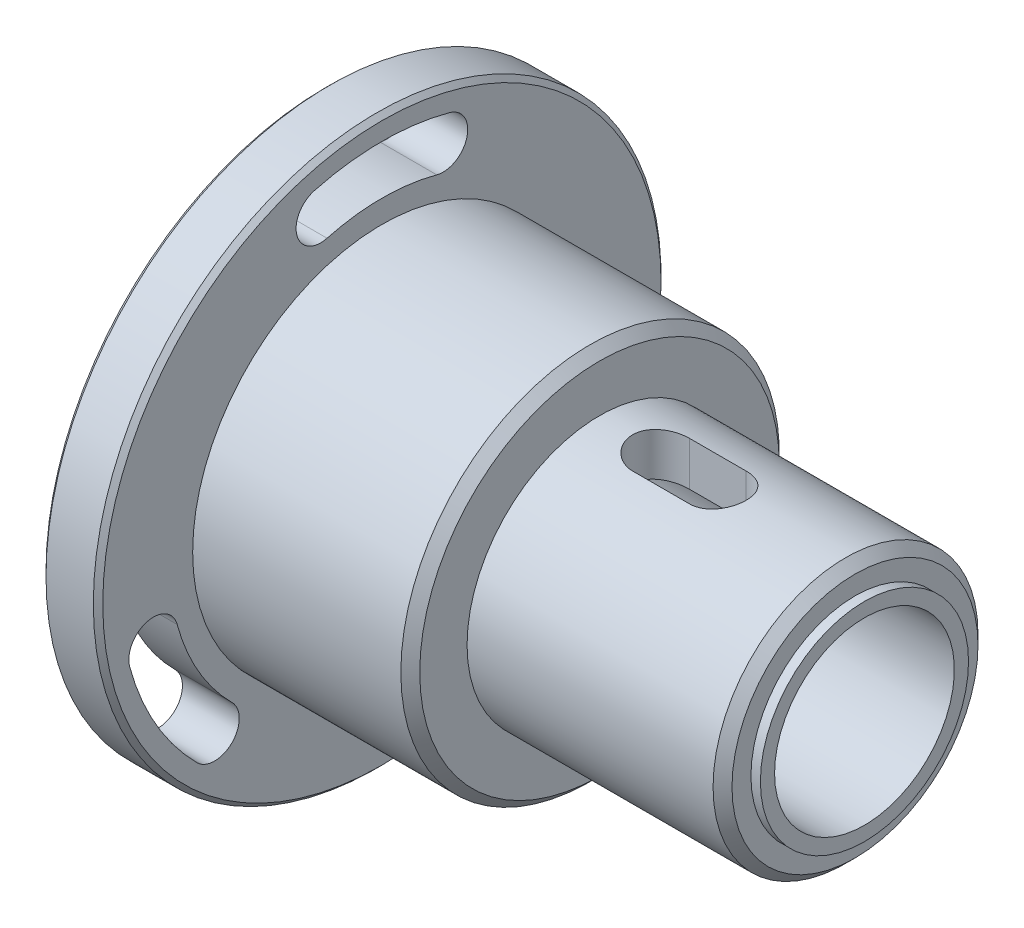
SolidWorks part; units mm, degrees
ref_plane "Vorne" through (0, 0, 0) normal (0, 0, 1) x (1, 0, 0)
ref_plane "Oben" through (0, 0, 0) normal (0, 1, 0) x (1, 0, 0)
ref_plane "Rechts" through (0, 0, 0) normal (1, 0, 0) x (0, 0, -1)
sketch "Skizze2" plane through (0, 0, 0) normal (0, 0, 1) x (1, 0, 0)
  line L0 (0, 0) -> (58.1234, 0) construction
  line L1 (0, 20) -> (0, 14)
  line L2 (0, 14) -> (14, 14)
  line L4 (14, 14) -> (15, 14)
  line L5 (14, 11) -> (14, 9.5)
  line L6 (14, 9.5) -> (60, 9.5)
  line L7 (60, 9.5) -> (60, 11)
  line L8 (60, 11) -> (59, 11)
  line L9 (59, 11) -> (59, 14)
  line L10 (59, 14) -> (32, 14)
  line L11 (32, 14) -> (32, 20)
  line L12 (32, 20) -> (9, 20)
  line L13 (9, 20) -> (9, 30)
  line L14 (9, 30) -> (3, 30)
  line L15 (3, 30) -> (3, 20)
  line L16 (3, 20) -> (0, 20)
  line L18 (14, 11) -> (15, 11)
  line L19 (15, 14) -> (15, 11)
  dimension "D2" = 28
  dimension "D3" = 28
  dimension "D4" = 19
  dimension "D5" = 14
  dimension "D6" = 15
  dimension "D7" = 3
  dimension "D8" = 60
  dimension "D9" = 40
  dimension "D10" = 28
  dimension "D11" = 6
  dimension "D12" = 51
  dimension "D13" = 22
  dimension "D14" = 1
  dimension "D15" = 40
  dimension "D16" = 22
revolve "Rotation1" add sketch "Skizze2" angle 360 about L0
sketch "Skizze3" plane through (0, 0, 0) normal (0, 1, 0) x (1, 0, 0)
  line L0 (38.5, 0) -> (44.5, 0) construction
  line L1 (59, 0) -> (32, 0) construction
  line L2 (38.5, -3) -> (44.5, -3)
  line L3 (38.5, 3) -> (44.5, 3)
  line L4 (60, -11) -> (60, 11) construction
  arc A0 (38.5, -3) -> (38.5, 3) centre (38.5, 0) cw
  arc A1 (44.5, -3) -> (44.5, 3) centre (44.5, 0) ccw
  dimension "D3" = 15.5
  dimension "D4" = 6
  dimension "D1" = 3
  dimension "D2" = 3
extrude "Linear austragen1" cut sketch "Skizze3" along normal through all
sketch "Skizze4" plane through (3, 0, 0) normal (-1, 0, 0) x (0, 0, 1)
  line L0 (0, 25) -> (0, 0) construction
  line L1 (0, 0) -> (-6.4705, 24.1481) construction
  line L2 (0, 0) -> (6.4705, 24.1481) construction
  arc A0 (-5.7975, 21.6367) -> (5.7975, 21.6367) centre (0, 0) cw
  arc A1 (-6.4705, 24.1481) -> (6.4705, 24.1481) centre (0, 0) cw construction
  arc A2 (-7.1434, 26.6596) -> (7.1434, 26.6596) centre (0, 0) cw
  arc A3 (-5.7975, 21.6367) -> (-7.1434, 26.6596) centre (-6.4705, 24.1481) cw
  arc A4 (5.7975, 21.6367) -> (7.1434, 26.6596) centre (6.4705, 24.1481) ccw
  dimension "D2" = 25
  dimension "D1" = 15
  dimension "D3" = 2.6
  dimension "D4" = 2.6
extrude "Linear austragen2" cut sketch "Skizze4" against normal through all
pattern_circular "Kreismuster1" count 3 over 360 about axis through (0, 0, 0) along (1, 0, 0) of "Linear austragen2"
chamfer "Fase1" distance 1 angle 45 1 edges at (59, 0, 14)
chamfer "Fase2" distance 1 angle 45 1 edges at (32, 0, 20)
chamfer "Fase3" distance 0.5 angle 45 3 edges at (9, 0, 30) (3, 0, 30) (0, 0, 20)
